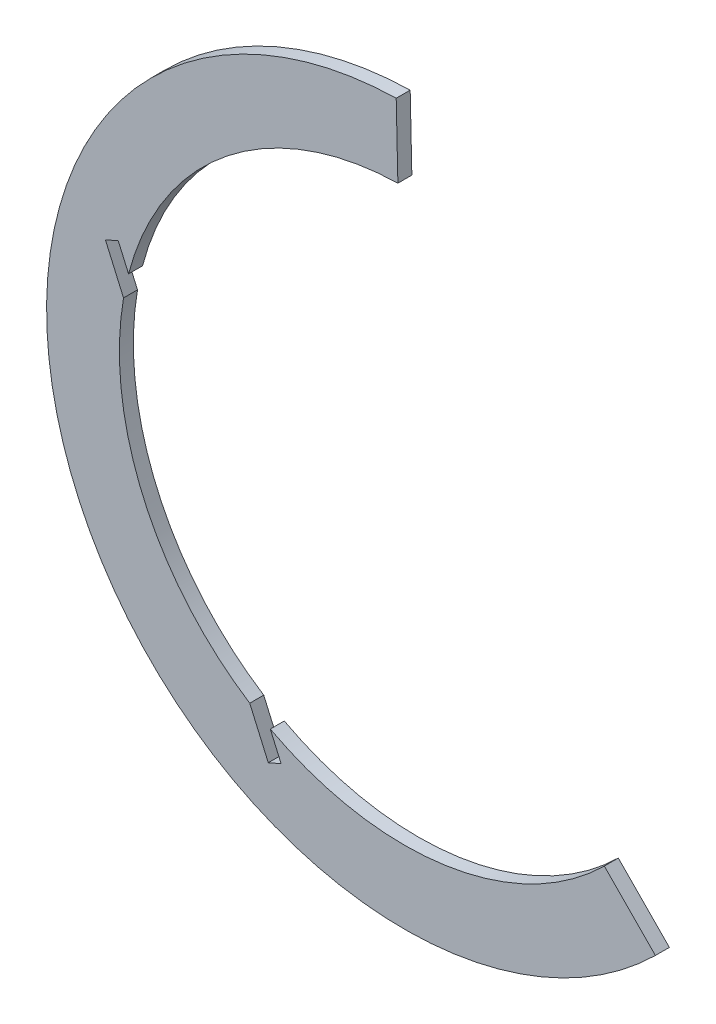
SolidWorks part; units mm, degrees
ref_plane "Front Plane" through (0, 0, 0) normal (0, 0, 1) x (1, 0, 0)
ref_plane "Top Plane" through (0, 0, 0) normal (0, 1, 0) x (1, 0, 0)
ref_plane "Right Plane" through (0, 0, 0) normal (1, 0, 0) x (0, 0, -1)
sketch "Sketch1" plane through (0, 0, 0) normal (0, 0, 1) x (1, 0, 0)
  line L0 (-37.653, -57.1739) -> (-32.0859, -62.8317)
  line L1 (-60.3472, 3.9865) -> (-60.165, -3.949)
  line L2 (-89.5298, -27.1954) -> (-90.6555, -24.6279)
  line L4 (-90.6555, -24.6279) -> (-92.0512, -25.2399)
  line L5 (-92.0512, -25.2399) -> (-90.0788, -29.7383)
  line L7 (-76.3165, -61.1261) -> (-74.2944, -65.7379)
  line L9 (-74.2944, -65.7379) -> (-72.8987, -65.1259)
  line L10 (-72.8987, -65.1259) -> (-74.0741, -62.4451)
  arc A0 (-60.3472, 3.9865) -> (-32.0859, -62.8317) centre (-59.4513, -35.0204) ccw
  arc A1 (-60.165, -3.949) -> (-89.5298, -27.1954) centre (-59.4513, -35.0204) ccw
  arc A2 (-90.0788, -29.7383) -> (-76.3165, -61.1261) centre (-59.4513, -35.0204) ccw
  arc A3 (-74.0741, -62.4451) -> (-37.653, -57.1739) centre (-59.4513, -35.0204) ccw
extrude "Boss-Extrude1" add sketch "Sketch1" along normal blind 1.524
